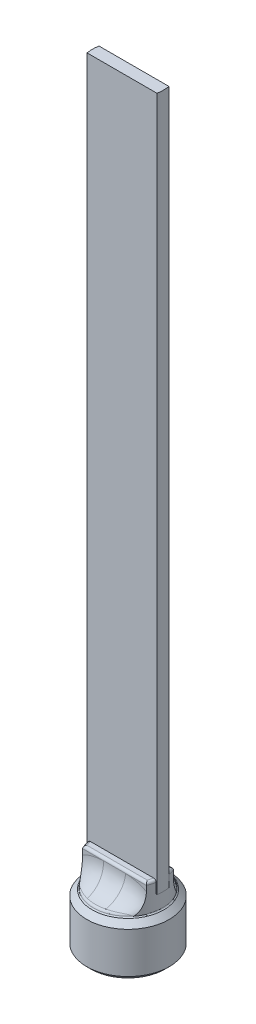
SolidWorks part; units mm, degrees
ref_plane "Front Plane" through (0, 0, 0) normal (0, 0, 1) x (1, 0, 0)
ref_plane "Top Plane" through (0, 0, 0) normal (0, 1, 0) x (1, 0, 0)
ref_plane "Right Plane" through (0, 0, 0) normal (1, 0, 0) x (0, 0, -1)
imported_body "Imported1"
sketch "Sketch1" plane through (0, 13.335, 0) normal (0, 1, 0) x (1, 0, 0)
  line L0 (-7.0111, 1.1938) -> (7.0111, 1.1938)
  line L1 (7.0111, -1.1938) -> (-7.0111, -1.1938)
  line L2 (6.8307, 1.1938) -> (-6.8307, 1.1938) construction
  line L3 (-6.8307, -1.1938) -> (6.8307, -1.1938) construction
  arc A0 (-7.0111, 1.1938) -> (-7.0111, -1.1938) centre (0, 0) ccw
  arc A1 (7.0111, -1.1938) -> (7.0111, 1.1938) centre (0, 0) ccw
  dimension "D1" = 14.224
extrude "Boss-Extrude1" add sketch "Sketch1" along normal offset from surface (139.065 mm away) 152.4
